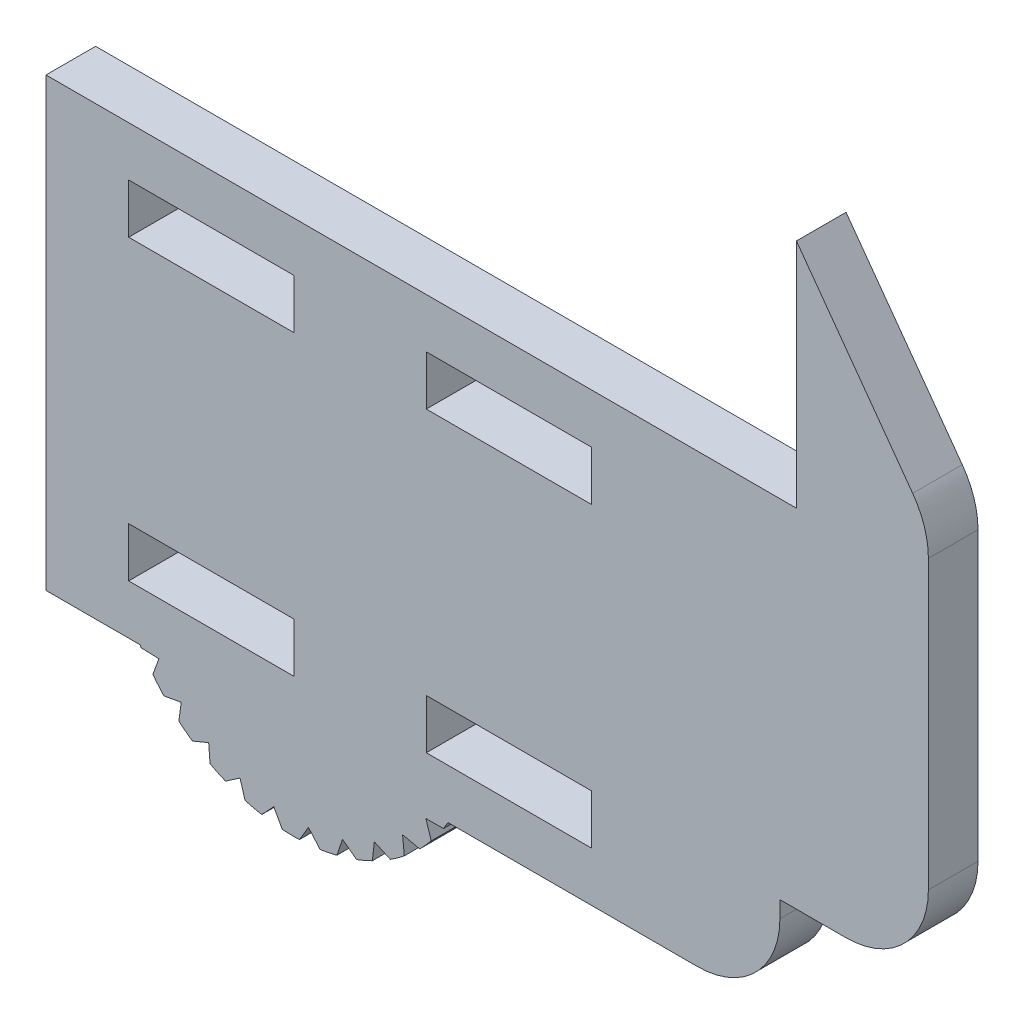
SolidWorks part; units mm, degrees
ref_plane "Plan de face" through (0, 0, 0) normal (0, 0, 1) x (1, 0, 0)
ref_plane "Plan de dessus" through (0, 0, 0) normal (0, 1, 0) x (1, 0, 0)
ref_plane "Plan de droite" through (0, 0, 0) normal (1, 0, 0) x (0, 0, -1)
sketch "Esquisse1" plane through (0, 0, 0) normal (0, 0, 1) x (1, 0, 0)
  line L0 (0, 35) -> (7.9813, 23.9834)
  line L1 (7.9813, 23.9834) -> (7.9813, 0)
  line L2 (-1, 0) -> (7.9813, 0)
  line L3 (-1, 0) -> (-1, -6)
  line L5 (-1, -6) -> (-45.3847, -6)
  line L6 (-45.3847, -6) -> (-45.3847, 21)
  line L7 (-45.3847, 21) -> (0, 21)
  line L8 (0, 21) -> (0, 35)
  line L9 (-200, 15) -> (-8, 15) construction
  dimension "D1" = 6
  dimension "D2" = 1
extrude "Boss.-Extru.1" add sketch "Esquisse1" along normal blind 3
sketch "Esquisse2" plane through (0, 0, 0) normal (0, 0, -1) x (-1, 0, 0)
  line L0 (1, 0) -> (-7.9813, 0) construction
  line L1 (12.3847, 15) -> (22.3847, 15)
  line L2 (12.3847, 15) -> (12.3847, 18)
  line L3 (12.3847, 18) -> (22.3847, 18)
  line L4 (22.3847, 15) -> (22.3847, 18)
  line L5 (30.3847, 18) -> (40.3847, 18)
  line L6 (30.3847, 18) -> (30.3847, 15)
  line L7 (30.3847, 15) -> (40.3847, 15)
  line L8 (40.3847, 18) -> (40.3847, 15)
  line L9 (0, 0) -> (200, 0) construction
  line L10 (12.3847, 0) -> (22.3847, 0)
  line L11 (12.3847, 0) -> (12.3847, -3)
  line L12 (12.3847, -3) -> (22.3847, -3)
  line L13 (22.3847, 0) -> (22.3847, -3)
  line L15 (30.3847, 0) -> (40.3847, 0)
  line L16 (30.3847, 0) -> (30.3847, -3)
  line L17 (30.3847, -3) -> (40.3847, -3)
  line L18 (40.3847, 0) -> (40.3847, -3)
  line L19 (45.3847, 21) -> (45.3847, -6) construction
  dimension "D1" = 3
  dimension "D2" = 10
  dimension "D3" = 15
  dimension "D4" = 5
  dimension "D5" = 8
extrude "Enlèv. mat.-Extru.1" cut sketch "Esquisse2" against normal blind 3
fillet "Congé1" radius 5 1 edges at (7.9813, 23.9834, 1.5)
fillet "Congé2" radius 5 1 edges at (7.9813, 0, 1.5)
sketch "Esquisse3" plane through (0, 0, 3) normal (0, 0, 1) x (1, 0, 0)
  line L0 (-45.3847, -6) -> (-1, -6) construction
  line L1 (-45.3847, 21) -> (-45.3847, -6) construction
  line L2 (-21.0742, -6) -> (-39.6951, -6)
  arc A0 (-21.0742, -6) -> (-39.6951, -6) centre (-30.3847, -0.657) cw
  dimension "D1" = 15
extrude "Boss.-Extru.2" add sketch "Esquisse3" against normal blind 3
fillet "Congé3" radius 5 1 edges at (-1, -6, 1.5)
sketch "Esquisse4" plane through (0, 0, 0) normal (0, 0, -1) x (-1, 0, 0)
  line L0 (30.3847, -0.657) -> (21.7028, -6.9703) construction
  line L1 (21.3496, -6.4535) -> (22.4136, -6.4535)
  line L2 (22.0856, -7.4657) -> (22.4136, -6.4535)
  arc A0 (21.0742, -6) -> (39.6951, -6) centre (30.3847, -0.657) ccw construction
  arc A1 (21.3496, -6.4535) -> (22.0856, -7.4657) centre (30.3847, -0.657) ccw
extrude "Enlèv. mat.-Extru.2" cut sketch "Esquisse4" against normal blind 10
pattern_circular "Répétition circulaire1" count 10 over 110 about axis through (-30.3847, -0.657, 0) along (0, 0, 1) of "Enlèv. mat.-Extru.2"
